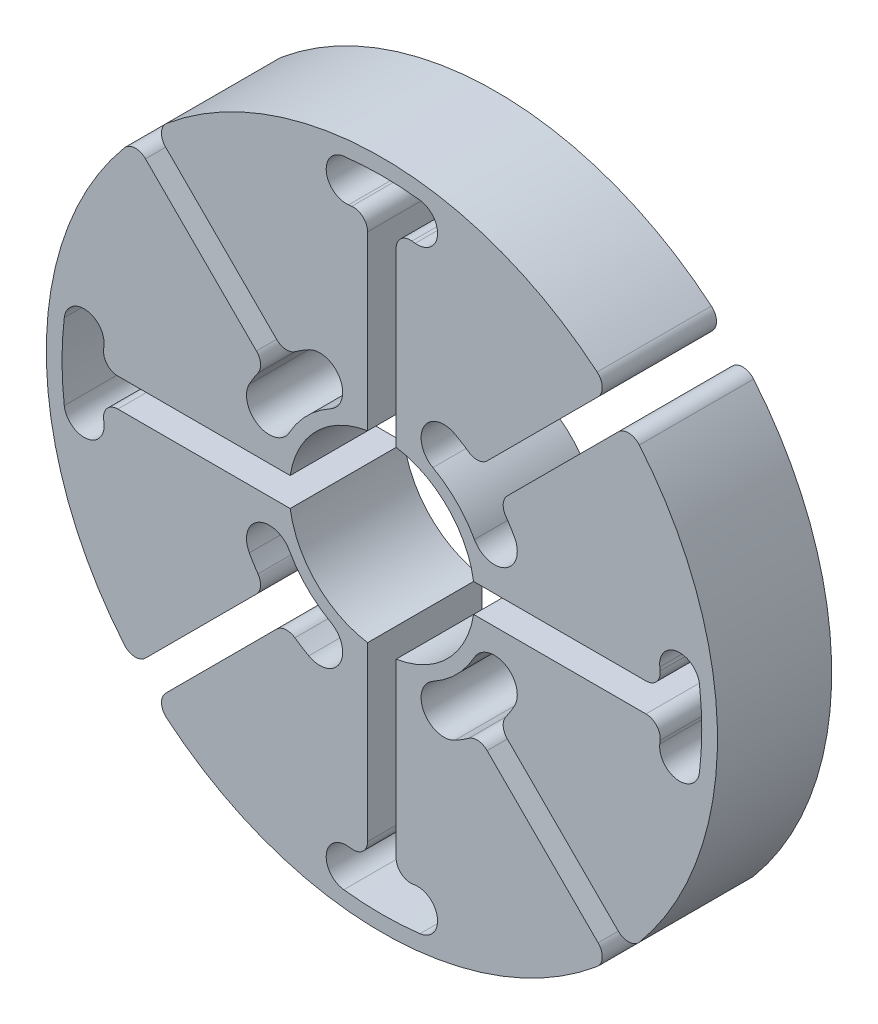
SolidWorks part; units mm, degrees
ref_plane "Front Plane" through (0, 0, 0) normal (0, 0, 1) x (1, 0, 0)
ref_plane "Top Plane" through (0, 0, 0) normal (0, 1, 0) x (1, 0, 0)
ref_plane "Right Plane" through (0, 0, 0) normal (1, 0, 0) x (0, 0, -1)
sketch "Sketch1" plane through (0, 0, 0) normal (0, 0, 1) x (1, 0, 0)
  line L3 (0, 0) -> (53.8251, 0) construction
  circle A0 centre (0, 0) radius 29.845
  circle A2 centre (0, 0) radius 8.255
  dimension "2.45" = 59.69
  dimension "D2" = 16.51
extrude "Boss-Extrude1" add sketch "Sketch1" along normal mid plane 10.16
sketch "Sketch2" plane through (0, 0, 5.08) normal (0, 0, 1) x (1, 0, 0)
  line L0 (-3.175, 26.4803) -> (3.175, 26.4803) construction
  line L1 (-1.27, 24.8596) -> (-1.27, 8.1567)
  line L2 (1.27, 24.8596) -> (1.27, 8.1567)
  line L3 (0, 0) -> (0, 36.8999) construction
  arc A0 (3.175, 26.4803) -> (-3.175, 26.4803) centre (0, 0) ccw construction
  arc A1 (3.3867, 28.2457) -> (-3.3867, 28.2457) centre (0, 0) ccw
  arc A2 (2.9633, 24.715) -> (-2.9633, 24.715) centre (0, 0) ccw
  arc A3 (2.9633, 24.715) -> (3.3867, 28.2457) centre (3.175, 26.4803) ccw
  arc A4 (-3.3867, 28.2457) -> (-2.9633, 24.715) centre (-3.175, 26.4803) ccw
  circle A5 centre (0, 0) radius 8.255 construction
  arc A6 (1.27, 8.1567) -> (-1.27, 8.1567) centre (0, 0) ccw
  point P4 (0, 26.67)
  dimension "D1" = 1.778
  dimension "D2" = 26.67
  dimension "D3" = 6.35
  dimension "D4" = 2.54
extrude "Cut-Extrude1" cut sketch "Sketch2" against normal through all contours L2 A2 L1 M7 | A1 A4 A2 A3
sketch "Sketch4" plane through (0, 0, 5.08) normal (0, 0, 1) x (1, 0, 0)
  line L0 (-10.0092, 5.5191) -> (-5.5191, 10.0092) construction
  line L1 (-8.0822, 8.0822) -> (0, 0) construction
  line L2 (0, 0) -> (0, 4.3212) construction
  line L3 (-10.3746, 8.5786) -> (-21.9825, 20.1865)
  line L4 (-20.1865, 21.9825) -> (-8.5786, 10.3746)
  arc A0 (-5.5191, 10.0092) -> (-10.0092, 5.5191) centre (0, 0) ccw construction
  arc A1 (-6.5003, 11.7886) -> (-11.7886, 6.5003) centre (0, 0) ccw
  arc A2 (-4.5379, 8.2298) -> (-8.2298, 4.5379) centre (0, 0) ccw
  arc A3 (-4.5379, 8.2298) -> (-6.5003, 11.7886) centre (-5.5191, 10.0092) ccw
  arc A4 (-11.7886, 6.5003) -> (-8.2298, 4.5379) centre (-10.0092, 5.5191) ccw
  circle A5 centre (0, 0) radius 29.845 construction
  arc A6 (-20.1865, 21.9825) -> (-21.9825, 20.1865) centre (0, 0) ccw
  point P4 (-8.0822, 8.0822)
  dimension "D1" = 11.43
  dimension "D2" = 2.032
  dimension "D3" = 6.35
  dimension "D4" = 45
  dimension "D5" = 2.54
  dimension "D6" = 45
extrude "Cut-Extrude2" cut sketch "Sketch4" against normal through all contours A1 L4 L3 M5 | A1 A4 A2 A3
fillet "Fillet1" radius 1.27 6 edges at (-1.27, 24.8596, 0) (1.27, 24.8596, 0) (-8.5786, 10.3746, 0) (-10.3746, 8.5786, 0) (-20.1865, 21.9825, 0) (-21.9825, 20.1865, 0)
pattern_circular "CirPattern1" count 4 over 360 about axis through (0, 0, 0) along (0, 0, 1) of "Cut-Extrude2", "Cut-Extrude1", "Fillet1"
equation "\"Slit Widths\"= .1"
equation "\"Slot Distance\"= 1.125"
equation "\"Slot Width\"= 0.25"
equation "\"Slot Radius\"=0.08"
equation "\"Inner Hole Diameter\"= .5"
equation "\"Outer Diameter\"=2.5"
